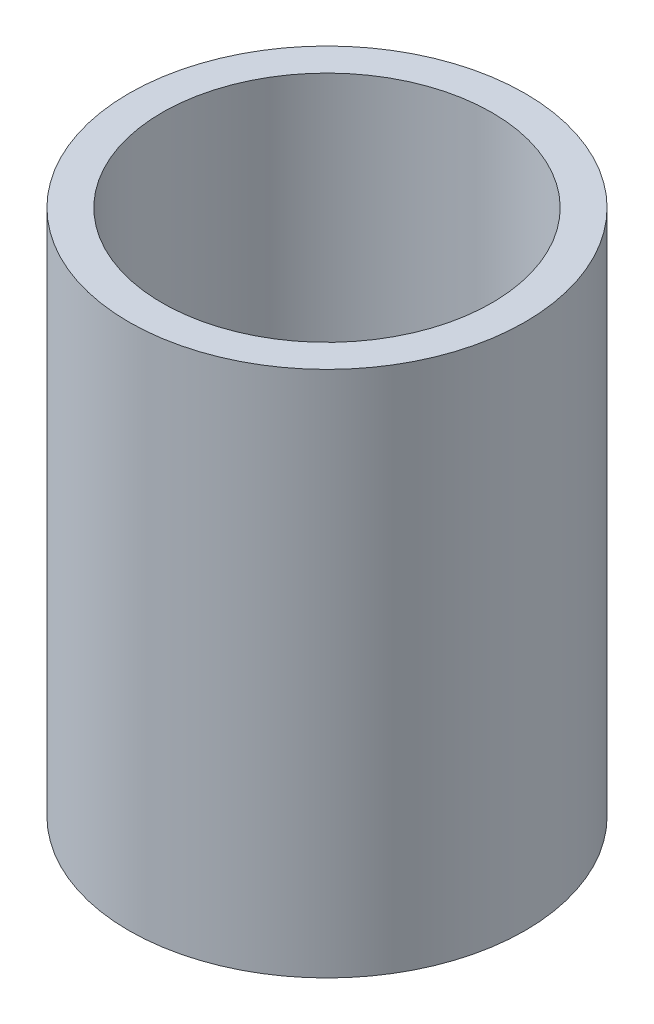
SolidWorks part; units mm, degrees
ref_plane "X_Y" through (0, 0, 0) normal (0, 0, 1) x (1, 0, 0)
ref_plane "Z_X" through (0, 0, 0) normal (0, 1, 0) x (1, 0, 0)
ref_plane "Y_Z" through (0, 0, 0) normal (1, 0, 0) x (0, 0, -1)
sketch "Sketch1" plane through (0, 0, 0) normal (0, 1, 0) x (1, 0, 0)
  circle A0 centre (0, 0) radius 1.195
  circle A1 centre (0, 0) radius 0.995
  dimension "D1" = 2.39
  dimension "D2" = 1.99
extrude "Boss-Extrude1" add sketch "Sketch1" along normal blind 3.18
